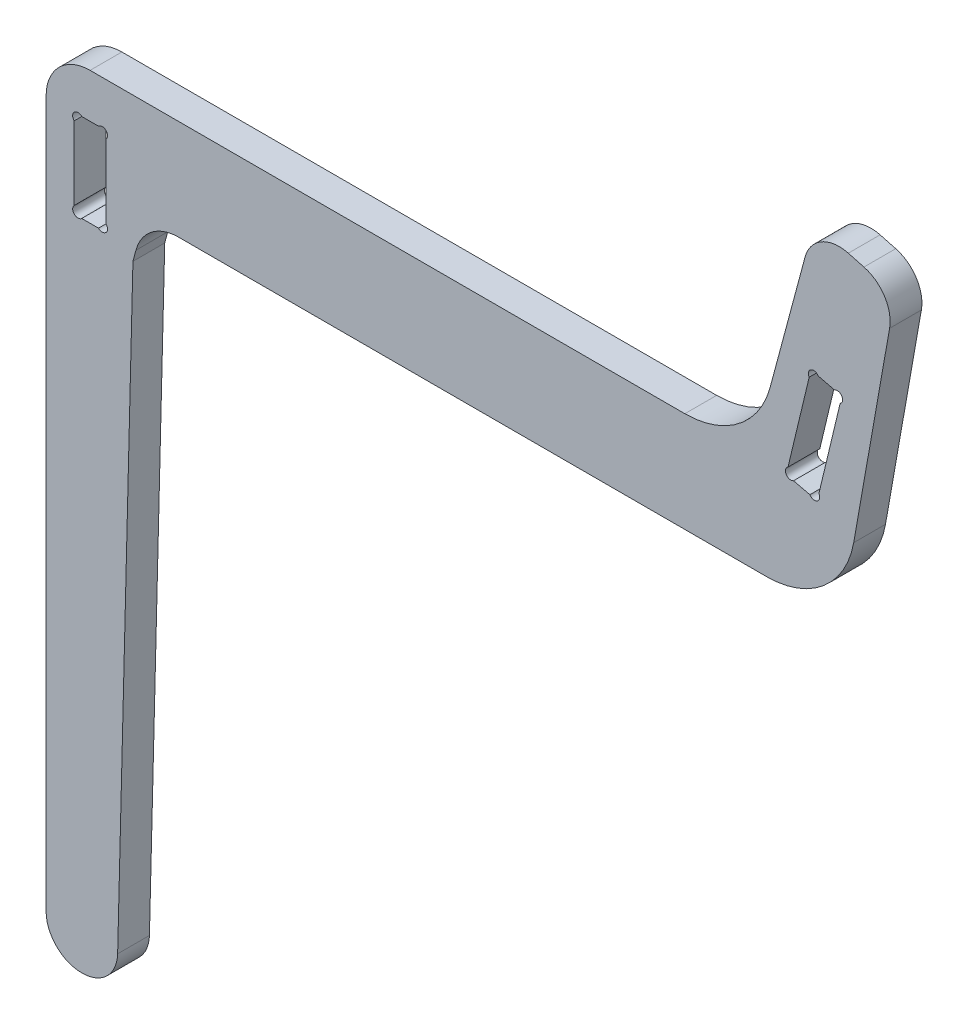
SolidWorks part; units mm, degrees
ref_plane "Plan de face" through (0, 0, 0) normal (0, 0, 1) x (1, 0, 0)
ref_plane "Plan de dessus" through (0, 0, 0) normal (0, 1, 0) x (1, 0, 0)
ref_plane "Plan de droite" through (0, 0, 0) normal (1, 0, 0) x (0, 0, -1)
sketch "Esquisse1" plane through (0, 0, 0) normal (0, 0, 1) x (1, 0, 0)
  line L0 (74.9, -6.7542) -> (407.9943, -6.7542)
  line L1 (457.2347, 34.5634) -> (477.5594, 149.8303)
  line L2 (0, 0) -> (0, 25.1)
  line L3 (24.9, 50) -> (361.6337, 50)
  line L4 (409.9299, 87.059) -> (429.7019, 160.8491)
  line L6 (0, 0) -> (0, -25.1)
  line L7 (24.9, -50) -> (25.1, -50)
  line L9 (434.8783, 180.1676) -> (480.7418, 167.8785) construction
  line L10 (412.1799, 95.4559) -> (465.4546, 81.181) construction
  line L11 (457.81, 174.023) -> (408.1364, -33.3895) construction
  line L12 (433.0264, 107.2408) -> (435.0894, 106.7468)
  line L13 (419.052, 48.8909) -> (436.557, 44.6986)
  line L14 (433.0264, 107.2408) -> (419.052, 48.8909)
  line L15 (450.5314, 103.0485) -> (436.557, 44.6986)
  line L16 (434.5953, 104.6838) -> (432.5323, 105.1779) construction
  line L17 (432.5323, 105.1779) -> (434.5953, 104.6838) construction
  line L18 (434.5953, 104.6838) -> (435.0894, 106.7468) construction
  line L19 (437.1523, 106.2527) -> (450.5314, 103.0485)
  line L20 (435.0894, 106.7468) -> (437.1523, 106.2527)
  line L21 (49.1521, -31.5426) -> (50.8479, -25.2116)
  line L22 (454.1968, 174.9912) -> (463.0396, 172.6218)
  line L23 (0, 25.1) -> (0, -394.9)
  line L24 (0, -394.9) -> (40, -394.9)
  line L25 (49.1521, -31.5426) -> (40, -394.9)
  arc A1 (457.2347, 34.5634) -> (407.9943, -6.7542) centre (407.9943, 43.2458) cw
  arc A2 (409.9299, 87.059) -> (361.6337, 50) centre (361.6337, 100) cw
  arc A3 (74.9, -6.7542) -> (50.8479, -25.2116) centre (74.9, -31.6542) ccw
  arc A6 (0, 25.1) -> (24.9, 50) centre (24.9, 25.1) cw
  arc A7 (463.0396, 172.6218) -> (477.5594, 149.8303) centre (457.8632, 153.3033) cw
  arc A8 (454.1968, 174.9912) -> (429.7019, 160.8491) centre (449.0204, 155.6727) ccw
  point P21 (50, -50)
  point P37 (441.3224, 105.1788)
  dimension "D3" = 20
  dimension "D6" = 50
  dimension "D9" = 24.9
  dimension "D12" = 113.995
  dimension "D14" = 105
  dimension "D1" = 100
  dimension "D2" = 420
  dimension "D4" = 40
  dimension "D10" = 60
  dimension "D11" = 18
  dimension "D13" = 186.9218
extrude "Boss.-Extru.1" add sketch "Esquisse1" along normal blind 18
fillet "Congé1" radius 20 2 edges at (0, -394.9, 9) (40, -394.9, 9)
sketch "Esquisse2" plane through (0, 0, 18) normal (0, 0, 1) x (1, 0, 0)
  line L0 (24.9, 50) -> (24.9, 0) construction
  line L8 (15.9, -25) -> (33.9, -25)
  line L9 (15.9, -25) -> (15.9, 25)
  line L10 (15.9, 25) -> (33.9, 25)
  line L11 (33.9, -25) -> (33.9, 25)
  line L12 (15.9, -25) -> (33.9, 25) construction
  line L13 (15.9, 25) -> (33.9, -25) construction
  dimension "D1" = 50
  dimension "D2" = 18
  dimension "D3" = 50
extrude "Enlèv. mat.-Extru.1" cut sketch "Esquisse2" against normal through all
sketch "Esquisse3" plane through (0, 0, 18) normal (0, 0, 1) x (1, 0, 0)
  line L0 (24.9, 25) -> (24.9, -25) construction
  line L1 (33.9, 25) -> (15.9, 25) construction
  line L2 (15.9, -25) -> (33.9, -25) construction
  line L3 (15.9, 0) -> (33.9, 0) construction
  line L4 (15.9, 25) -> (15.9, -25) construction
  line L5 (33.9, -25) -> (33.9, 25) construction
  line L6 (18.0213, 22.8787) -> (18.0213, 25) construction
  line L7 (18.0213, 22.8787) -> (15.9, 22.8787) construction
  circle A0 centre (18.0213, 22.8787) radius 3
  circle A1 centre (31.7787, -22.8787) radius 3
  circle A2 centre (31.7787, 22.8787) radius 3
  circle A3 centre (18.0213, -22.8787) radius 3
  point P12 (24.9, 0)
  point P23 (24.9, 0)
  dimension "D1" = 6
  dimension "D2" = 2
extrude "Enlèv. mat.-Extru.2" cut sketch "Esquisse3" against normal blind 18
sketch "Esquisse4" plane through (0, 0, 18) normal (0, 0, 1) x (1, 0, 0)
  line L0 (441.7789, 105.1447) -> (427.8045, 46.7947) construction
  line L1 (433.0264, 107.2408) -> (450.5314, 103.0485) construction
  line L2 (419.052, 48.8909) -> (436.557, 44.6986) construction
  line L3 (426.0392, 78.0659) -> (443.5442, 73.8736) construction
  line L4 (433.0264, 107.2408) -> (419.052, 48.8909) construction
  line L5 (450.5314, 103.0485) -> (436.557, 44.6986) construction
  line L6 (434.5953, 104.6838) -> (435.0894, 106.7468) construction
  line L7 (434.5953, 104.6838) -> (432.5323, 105.1779) construction
  circle A0 centre (434.5953, 104.6838) radius 3
  circle A1 centre (434.9881, 47.2556) radius 3
  circle A2 centre (447.9743, 101.4796) radius 3
  circle A3 centre (421.6091, 50.4598) radius 3
  point P12 (434.7917, 75.9697)
  point P22 (434.7917, 75.9697)
  dimension "D1" = 6
  dimension "D2" = 2
extrude "Enlèv. mat.-Extru.3" cut sketch "Esquisse4" against normal through all
